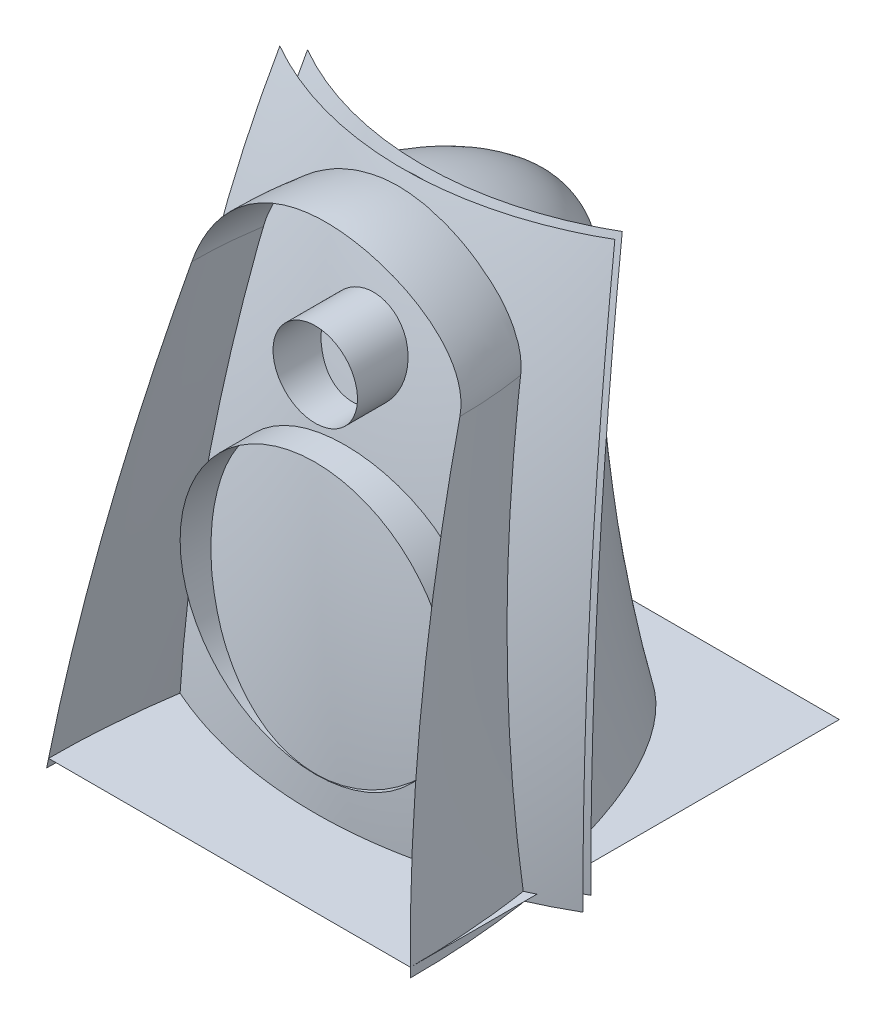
SolidWorks part; units mm, degrees
ref_plane "Front Plane" through (0, 0, 0) normal (0, 0, 1) x (1, 0, 0)
ref_plane "Top Plane" through (0, 0, 0) normal (0, 1, 0) x (1, 0, 0)
ref_plane "Right Plane" through (0, 0, 0) normal (1, 0, 0) x (0, 0, -1)
sketch "Sketch1" plane through (0, 0, 0) normal (1, 0, 0) x (0, 0, -1)
  line L0 (250, 0) -> (250, 300) construction
  arc A0 (0, 0) -> (50, 300) centre (925, 0) cw
  dimension "D1" = 300
  dimension "D2" = 50
  dimension "D3" = 250
surface "Face of Baffle" sketch "Sketch1" parameters "D1"=60
sketch "Sketch2" plane through (0, 0, 0) normal (0, 1, 0) x (1, 0, 0)
  line L0 (0, 0) -> (0, 177.8) construction
  arc A1 (-125, 33.4936) -> (125, 33.4936) centre (0, 250) ccw construction
  ellipse E0 centre (0, -50.8) end of major axis (0, 177.8) minor radius 107.1101 (107.1101, -50.8) -> (-107.1101, -50.8) ccw
  point P3 (-101.6, 21.5762)
  dimension "D1" = 177.8
  dimension "D2" = 50.8
  dimension "D3" = 203.2
ref_plane "Housing Loft Top" through (0, 240, 0) normal (0, 1, 0) x (-1, 0, 0)
sketch "Sketch3" plane through (0, 240, 152.4) normal (0, -1, 0) x (-1, 0, 0)
  line L0 (0, 184.0775) -> (0, 298.3775) construction
  arc A1 (-109.1612, 213.3272) -> (109.1612, 213.3272) centre (0, 402.4) ccw
  arc A2 (-109.1612, 213.3272) -> (109.1612, 213.3272) centre (0, 402.4) ccw construction
  ellipse E0 centre (0, 158.6775) end of major axis (0, 298.3775) minor radius 79.3773 (79.3773, 158.6775) -> (-79.3773, 158.6775) ccw
  point P3 (-76.2, 197.8071)
  dimension "D1" = 114.3
  dimension "D2" = 152.4
  dimension "D3" = 25.4
sketch "Sketch4" plane through (0, 0, 0) normal (1, 0, 0) x (0, 0, -1)
  line L0 (145.9775, 240) -> (145.9775, 394.4787) construction
  arc A0 (177.8, 0) -> (145.9775, 240) centre (1066.9102, 240) cw
surface "Housing Loft"
sketch "Sketch6" plane through (0, 240, 0) normal (0, 1, 0) x (-1, 0, 0)
  line L0 (0, 0) -> (0, -303.7299) construction
  spline S1 degree 3 poles (-803.8426, -475.2252) (-300.7952, 512.4351) (96.1507, 234.6442) (78.4797, -28.1731) (77.2473, -39.0655) (75.5018, -49.8871) (73.2267, -60.6115) (70.3916, -71.2004) (66.9661, -81.6156) (62.9024, -91.799) (58.1474, -101.6806) (52.6313, -111.1611) (46.2732, -120.1031) (40.1968, -126.9419) (34.8255, -131.9025) (30.537, -135.3175) (25.9834, -138.3771) (21.1762, -141.0155) (16.127, -143.1673) (10.8798, -144.7683) (5.4786, -145.7543) (1.8265, -145.9775) (-1.8265, -145.9775) (-5.4786, -145.7543) (-10.8799, -144.7683) (-16.1271, -143.1672) (-21.1763, -141.0154) (-25.9835, -138.377) (-30.5371, -135.3175) (-34.8256, -131.9024) (-40.1969, -126.9418) (-46.2733, -120.103) (-52.6314, -111.161) (-58.1474, -101.6805) (-62.9025, -91.7988) (-66.9661, -81.6155) (-70.3916, -71.2003) (-73.2267, -60.6114) (-75.5018, -49.887) (-77.2474, -39.0654) (-78.4797, -28.1731) (-96.1507, 234.6446) (300.7964, 512.4354) (803.84, -475.2) knots -2.159122 -2.159122 -2.159122 -2.159122 0.03125 0.0625 0.09375 0.125 0.15625 0.1875 0.21875 0.25 0.28125 0.3125 0.34375 0.375 0.390625 0.40625 0.421875 0.4375 0.453125 0.46875 0.484375 0.5 0.5 0.515625 0.53125 0.546875 0.5625 0.578125 0.59375 0.609375 0.625 0.65625 0.6875 0.71875 0.75 0.78125 0.8125 0.84375 0.875 0.90625 0.9375 0.96875 3.159132 3.159132 3.159132 3.159132 only from (79.3773, -6.2775) to (-79.3773, -6.2775) construction
  spline S2 degree 3 poles (0, -145.9775) (-1.8265, -145.9775) (-5.4786, -145.7543) (-10.8799, -144.7683) (-16.1271, -143.1672) (-21.1763, -141.0154) (-25.9835, -138.377) (-30.5371, -135.3175) (-34.8256, -131.9024) (-40.1969, -126.9418) (-46.2733, -120.103) (-52.6314, -111.161) (-58.1474, -101.6805) (-62.9025, -91.7988) (-66.9661, -81.6155) (-70.3916, -71.2003) (-73.2267, -60.6114) (-75.5018, -49.887) (-77.2474, -39.0654) (-78.4797, -28.1731) (-79.2151, -17.2364) (-79.3773, -9.9305) (-79.3773, -6.2775) knots 0.5 0.5 0.5 0.5 0.515625 0.53125 0.546875 0.5625 0.578125 0.59375 0.609375 0.625 0.65625 0.6875 0.71875 0.75 0.78125 0.8125 0.84375 0.875 0.90625 0.9375 0.96875 1 1 1 1
sketch "Sketch7" plane through (0, 240, 0) normal (0, -1, 0) x (1, 0, 0)
  line L0 (0, 0) -> (0, -303.7299) construction
  spline S2 degree 3 poles (0, -145.9775) (-1.8265, -145.9775) (-5.4786, -145.7543) (-10.8799, -144.7683) (-16.1271, -143.1672) (-21.1763, -141.0154) (-25.9835, -138.377) (-30.5371, -135.3175) (-34.8256, -131.9024) (-40.1969, -126.9418) (-46.2733, -120.103) (-52.6314, -111.161) (-58.1474, -101.6805) (-62.9025, -91.7988) (-66.9661, -81.6155) (-70.3916, -71.2003) (-73.2267, -60.6114) (-75.5018, -49.887) (-77.2474, -39.0654) (-78.4797, -28.1731) (-79.2151, -17.2364) (-79.3773, -9.9305) (-79.3773, -6.2775) knots 0.5 0.5 0.5 0.5 0.515625 0.53125 0.546875 0.5625 0.578125 0.59375 0.609375 0.625 0.65625 0.6875 0.71875 0.75 0.78125 0.8125 0.84375 0.875 0.90625 0.9375 0.96875 1 1 1 1
sketch "Sketch8" plane through (0, 0, 0) normal (1, 0, 0) x (0, 0, -1)
  line L0 (0, 240) -> (303.7299, 240) construction
  ellipse E0 centre (6.2775, 240) end of major axis (-133.4225, 240) minor radius 60 (145.9775, 240) -> (6.2775, 300) ccw
surface "Housing Cap"
surface "Inside of Baffle" parameters "D1"=12.7
sketch "Sketch9" plane through (0, 0, 0) normal (0, 1, 0) x (1, 0, 0)
  line L0 (107.1101, 177.8) -> (-107.1101, 177.8) construction
  line L1 (-107.1101, -50.8) -> (107.1101, -50.8)
  line L2 (-107.1101, -50.8) -> (-107.1101, 203.2)
  line L3 (-107.1101, 203.2) -> (107.1101, 203.2)
  line L4 (107.1101, -50.8) -> (107.1101, 203.2)
  spline S1 degree 3 poles (107.1101, -50.8) (107.1101, -45.1256) (106.9122, -33.7767) (106.0187, -16.7743) (104.5175, 0.1854) (102.3904, 17.0783) (99.6101, 33.8764) (96.139, 50.546) (91.9264, 67.0446) (86.9057, 83.3167) (80.9884, 99.2862) (74.0574, 114.8462) (65.9568, 129.8349) (58.0586, 141.6432) (50.9163, 150.472) (45.1082, 156.7015) (38.8113, 162.441) (31.9936, 167.5553) (24.6422, 171.8766) (16.784, 175.2011) (8.5112, 177.3153) (2.8372, 177.8) (-2.8372, 177.8) (-8.5112, 177.3153) (-16.784, 175.2011) (-24.6423, 171.8766) (-31.9937, 167.5552) (-38.8114, 162.4409) (-45.1083, 156.7014) (-50.9164, 150.4719) (-58.0587, 141.6431) (-65.957, 129.8347) (-74.0575, 114.846) (-80.9885, 99.286) (-86.9057, 83.3165) (-91.9265, 67.0444) (-96.139, 50.5458) (-99.6102, 33.8763) (-102.3905, 17.0782) (-104.5176, 0.1853) (-106.0187, -16.7744) (-106.9122, -33.7768) (-107.1101, -45.1256) (-107.1101, -50.8) knots 0 0 0 0 0.03125 0.0625 0.09375 0.125 0.15625 0.1875 0.21875 0.25 0.28125 0.3125 0.34375 0.375 0.390625 0.40625 0.421875 0.4375 0.453125 0.46875 0.484375 0.5 0.5 0.515625 0.53125 0.546875 0.5625 0.578125 0.59375 0.609375 0.625 0.65625 0.6875 0.71875 0.75 0.78125 0.8125 0.84375 0.875 0.90625 0.9375 0.96875 1 1 1 1 construction
  dimension "D1" = 25.4
surface "Base" sketch "Sketch9"
sketch "Sketch10" plane through (0, 0, 0) normal (0, 0, 1) x (1, 0, 0)
  circle A0 centre (0, 100) radius 80
  circle A1 centre (0, 225) radius 25
  dimension "D2" = 160
  dimension "D3" = 20
  dimension "D4" = 50
  dimension "D1" = 20
surface "Driver Mounts" sketch "Sketch10" parameters "D1"=76.2
surface "Surface-Knit1"
surface "Surface-Extend1" parameters "D1"=5, "D2"=5
surface "Surface-Extend2" parameters "D1"=5, "D2"=5
surface "Surface-Extend3" parameters "D1"=5
